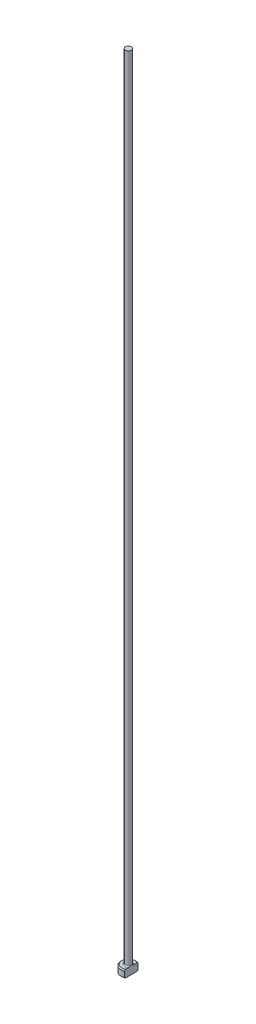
SolidWorks part; units mm, degrees
ref_plane "Front Plane" through (0, 0, 0) normal (0, 0, 1) x (1, 0, 0)
ref_plane "Top Plane" through (0, 0, 0) normal (0, 1, 0) x (1, 0, 0)
ref_plane "Right Plane" through (0, 0, 0) normal (1, 0, 0) x (0, 0, -1)
sketch "Sketch1" plane through (0, 0, 0) normal (0, 0, 1) x (1, 0, 0)
  line L0 (0, 259.9588) -> (0, -15.1925) construction
  line L1 (0, 0) -> (-1.5, 0)
  line L2 (-1.5, 0) -> (-1.5, 1.5)
  line L3 (-1.5, 1.5) -> (-0.6, 1.5)
  line L4 (-0.6, 1.5) -> (-0.6, 160)
  line L5 (-0.6, 160) -> (0, 160)
  line L6 (0, 160) -> (0, 0)
  dimension "L" = 160
  dimension "H" = 3
  dimension "T" = 1.5
  dimension "D" = 1.2
revolve "Revolve1" add sketch "Sketch1" angle 360 about L0
chamfer "Chamfer1" distance 0.2 angle 45 2 edges at (0, 1.5, 1.5) (0, 0, 1.5)
fillet "Fillet1" radius 0.2 1 edges at (0, 1.5, 0.6)
sketch "Sketch2" plane through (0, 0, 0) normal (0, 1, 0) x (1, 0, 0)
  line L0 (0.6, 1.3748) -> (0.6, -1.3748)
  circle A0 centre (0, 0) radius 1.5 construction
  arc A1 (0.6, -1.3748) -> (0.6, 1.3748) centre (0, 0) ccw
  circle A2 centre (0, 0) radius 0.6 construction
extrude "KEY" cut sketch "Sketch2" along normal through all
